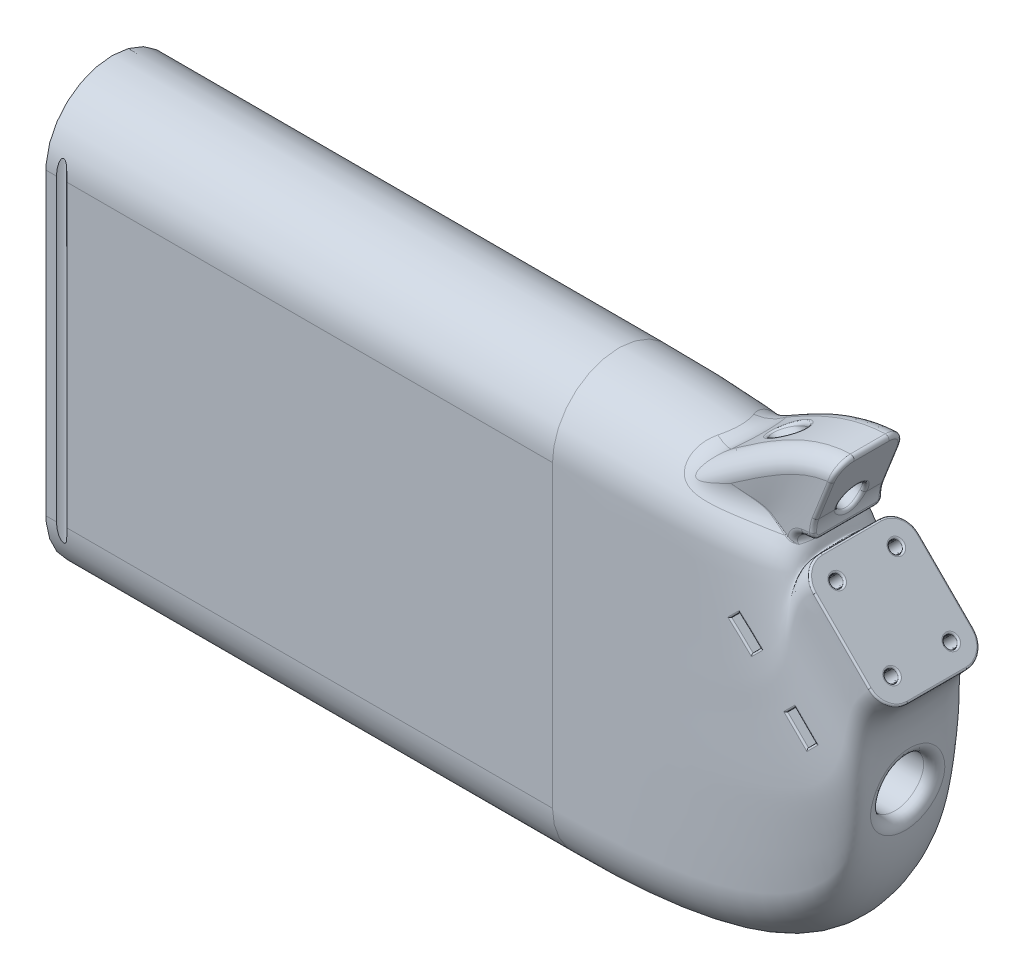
SolidWorks part; units mm, degrees
ref_plane "Front Plane" through (0, 0, 0) normal (0, 0, 1) x (1, 0, 0)
ref_plane "Top Plane" through (0, 0, 0) normal (0, 1, 0) x (1, 0, 0)
ref_plane "Right Plane" through (0, 0, 0) normal (1, 0, 0) x (0, 0, -1)
other "Converted1"
